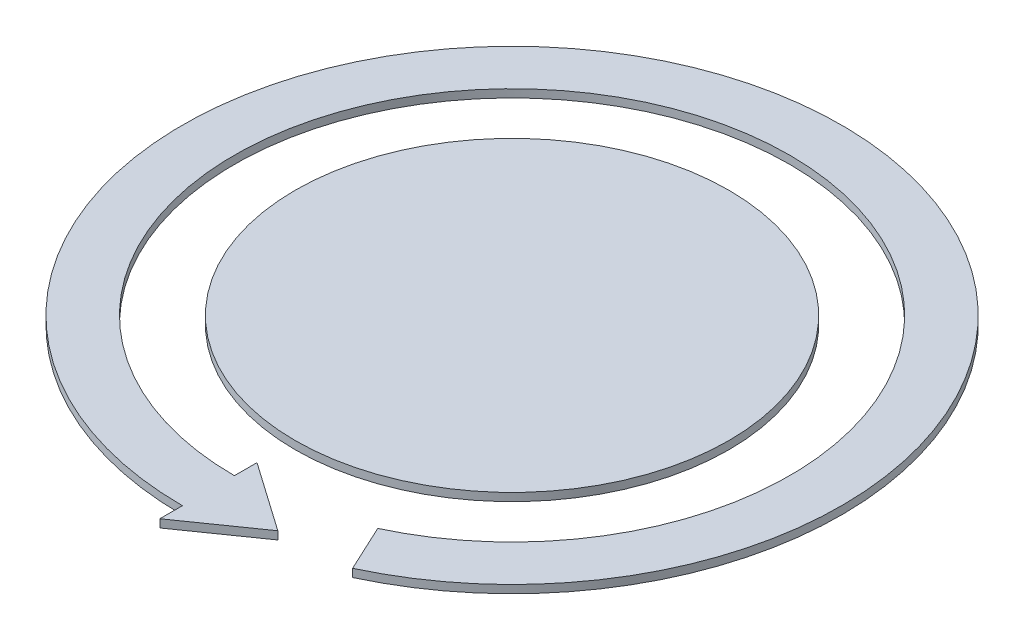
SolidWorks part; units mm, degrees
ref_plane "Ebene vorne" through (0, 0, 0) normal (0, 0, 1) x (1, 0, 0)
ref_plane "Ebene oben" through (0, 0, 0) normal (0, 1, 0) x (1, 0, 0)
ref_plane "Ebene rechts" through (0, 0, 0) normal (1, 0, 0) x (0, 0, -1)
sketch "Skizze1" plane through (0, 0, 0) normal (0, 1, 0) x (1, 0, 0)
  line L0 (29.2874, -62.8071) -> (34.7709, -74.5665)
  line L1 (0, -69.3) -> (0, -63.6609)
  line L2 (0, -63.6609) -> (17.3186, -75.7875)
  line L3 (17.3186, -75.7875) -> (0, -87.9141)
  line L4 (0, -87.9141) -> (0, -82.275)
  line L5 (0, -63.6609) -> (0, 0) construction
  line L6 (29.2874, -62.8071) -> (0, 0) construction
  circle A0 centre (0, 0) radius 54.125
  arc A1 (29.2874, -62.8071) -> (0, -69.3) centre (0, 0) ccw
  arc A2 (34.7709, -74.5665) -> (0, -82.275) centre (0, 0) ccw
  arc A3 (7.4759, -68.8956) -> (29.2874, -62.8071) centre (0, 0) ccw construction
  arc A4 (8.7145, -81.8122) -> (34.7709, -74.5665) centre (0, 0) ccw construction
  arc A5 (0, -69.3) -> (7.4759, -68.8956) centre (0, 0) ccw construction
  arc A6 (0, -82.275) -> (8.7145, -81.8122) centre (0, 0) ccw construction
  point P2 (18.4672, -76.5918)
  point P3 (0, 0)
  dimension "D1" = 108.25
  dimension "D2" = 138.6
  dimension "D3" = 164.55
  dimension "D4" = 125
  dimension "D5" = 125
  dimension "D9" = 63.6609
  dimension "D11" = 25
extrude "Aufsatz-Linear austragen1" add sketch "Skizze1" along normal blind 2
